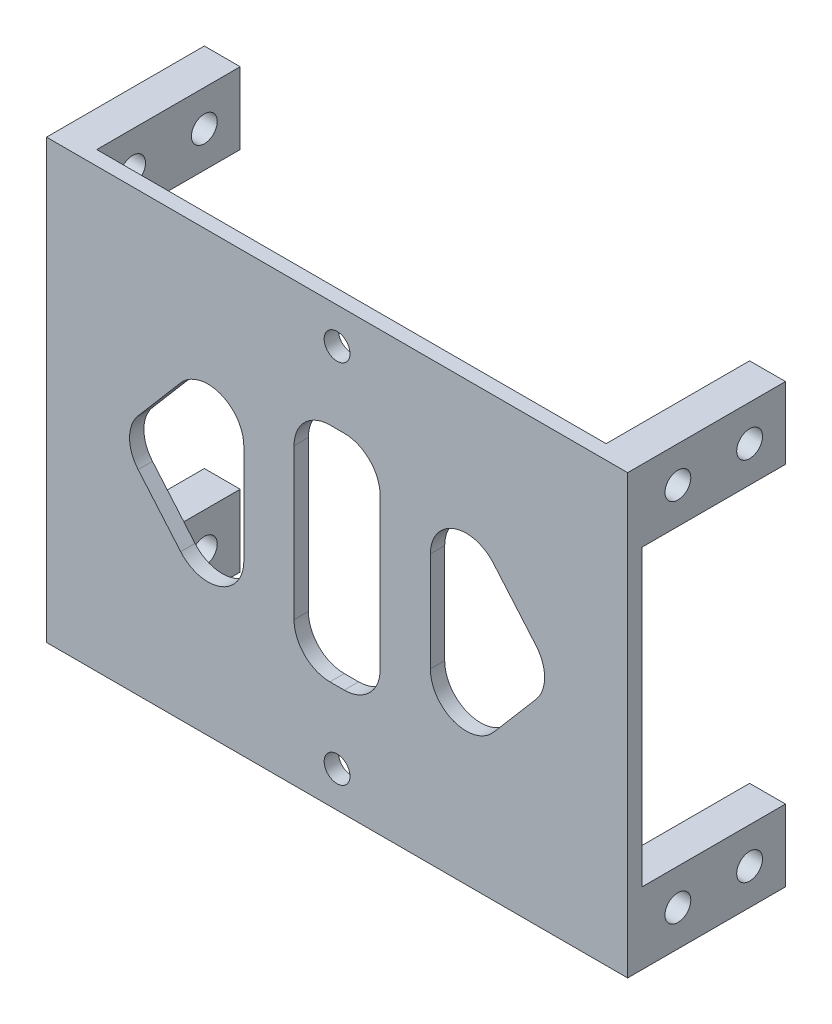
SolidWorks part; units mm, degrees
ref_plane "Plan de face" through (0, 0, 0) normal (0, 0, 1) x (1, 0, 0)
ref_plane "Plan de dessus" through (0, 0, 0) normal (0, 1, 0) x (1, 0, 0)
ref_plane "Plan de droite" through (0, 0, 0) normal (1, 0, 0) x (0, 0, -1)
sketch "Esquisse1" plane through (0, 0, 0) normal (0, 0, 1) x (1, 0, 0)
  line L0 (0, 0) -> (81, 0)
  line L1 (0, 0) -> (0, 61)
  line L2 (81, 0) -> (81, 61)
  line L3 (0, 61) -> (81, 61)
  line L4 (10, 30.5) -> (27.5, 51)
  line L5 (27.5, 51) -> (27.5, 10)
  line L6 (27.5, 10) -> (10, 30.5)
  line L7 (53.5, 51) -> (53.5, 10)
  line L8 (53.5, 10) -> (71, 30.5)
  line L9 (71, 30.5) -> (53.5, 51)
  line L10 (34.5, 46) -> (46.5, 46)
  line L11 (46.5, 46) -> (46.5, 15)
  line L12 (46.5, 15) -> (34.5, 15)
  line L13 (34.5, 15) -> (34.5, 46)
  line L31 (10, 30.5) -> (27.5, 30.5) construction
  circle A0 centre (40.5, 56) radius 1.8
  circle A1 centre (40.5, 5) radius 1.8
  point P17 (40.5, 15)
  dimension "D3" = 3.6
  dimension "D4" = 3.6
  dimension "D1" = 81
  dimension "D2" = 61
  dimension "D5" = 5
  dimension "D6" = 5
  dimension "D7" = 40.5
  dimension "D8" = 40.5
  dimension "D9" = 7
  dimension "D10" = 7
  dimension "D11" = 12
  dimension "D12" = 10
  dimension "D13" = 10
  dimension "D14" = 10
  dimension "D15" = 10
  dimension "D16" = 30.5
  dimension "D17" = 30.5
  dimension "D18" = 10
  dimension "D19" = 10
  dimension "D20" = 10
  dimension "D21" = 10
  dimension "D23" = 40.5
extrude "Boss.-Extru.1" add sketch "Esquisse1" along normal blind 2
sketch "Esquisse2" plane through (0, 0, 0) normal (0, 0, -1) x (-1, 0, 0)
  line L0 (-81, 61) -> (-76, 61)
  line L1 (-81, 61) -> (-81, 51)
  line L2 (-76, 61) -> (-76, 51)
  line L3 (-81, 51) -> (-76, 51)
  line L4 (-81, 61) -> (0, 61) construction
  line L5 (-81, 0) -> (-76, 0)
  line L6 (-81, 0) -> (-81, 10)
  line L7 (-76, 0) -> (-76, 10)
  line L8 (-81, 10) -> (-76, 10)
  line L9 (0, 0) -> (-81, 0) construction
  line L10 (0, 61) -> (-5, 61)
  line L11 (0, 61) -> (0, 51)
  line L12 (-5, 61) -> (-5, 51)
  line L13 (0, 51) -> (-5, 51)
  line L14 (0, 0) -> (-5, 0)
  line L15 (0, 0) -> (0, 10)
  line L16 (-5, 0) -> (-5, 10)
  line L17 (0, 10) -> (-5, 10)
  dimension "D1" = 10
  dimension "D2" = 5
  dimension "D3" = 10
  dimension "D4" = 5
extrude "Boss.-Extru.2" add sketch "Esquisse2" along normal blind 20
sketch "Esquisse3" plane through (0, 0, 0) normal (-1, 0, 0) x (0, 0, 1)
  line L0 (-20, 51) -> (-20, 61) construction
  line L1 (-20, 51) -> (0, 51) construction
  line L2 (-20, 10) -> (0, 10) construction
  line L3 (-20, 0) -> (-20, 10) construction
  circle A0 centre (-15, 56) radius 1.8
  circle A1 centre (-5, 56) radius 1.8
  circle A2 centre (-15, 5) radius 1.8
  circle A3 centre (-5, 5) radius 1.8
  dimension "D9" = 3.6
  dimension "D10" = 3.6
  dimension "D11" = 3.6
  dimension "D12" = 3.6
  dimension "D1" = 5
  dimension "D2" = 5
  dimension "D3" = 5
  dimension "D4" = 5
  dimension "D5" = 5
  dimension "D6" = 5
  dimension "D7" = 10
  dimension "D8" = 10
extrude "Enlèv. mat.-Extru.1" cut sketch "Esquisse3" against normal through all
fillet "Congé2" radius 5 10 edges at (71, 30.5, 1) (46.5, 15, 1) (27.5, 10, 1) (34.5, 15, 1) (53.5, 10, 1) (53.5, 51, 1) (34.5, 46, 1) (46.5, 46, 1) (27.5, 51, 1) (10, 30.5, 1)
